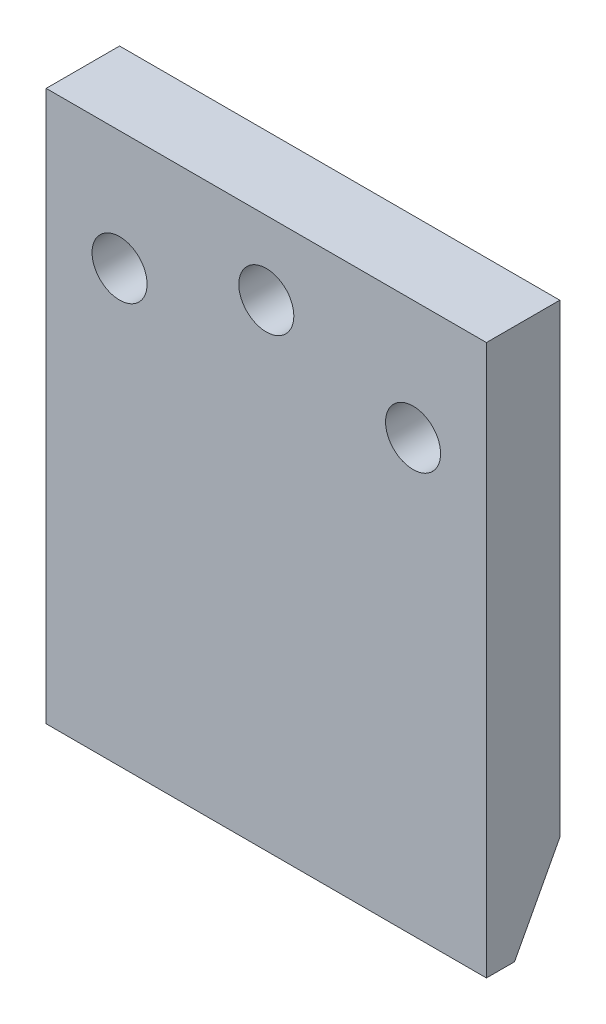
SolidWorks part; units mm, degrees
ref_plane "Front Plane" through (0, 0, 0) normal (0, 0, 1) x (1, 0, 0)
ref_plane "Top Plane" through (0, 0, 0) normal (0, 1, 0) x (1, 0, 0)
ref_plane "Right Plane" through (0, 0, 0) normal (1, 0, 0) x (0, 0, -1)
sketch "Sketch1" plane through (0, 0, 0) normal (0, 0, 1) x (1, 0, 0)
  line L0 (0, 0) -> (0, 3.937) construction
  line L1 (38.1, 47.625) -> (-38.1, 47.625)
  line L2 (38.1, 47.625) -> (38.1, -47.625)
  line L3 (38.1, -47.625) -> (-38.1, -47.625)
  line L4 (-38.1, 47.625) -> (-38.1, -47.625)
  line L5 (38.1, 47.625) -> (-38.1, -47.625) construction
  line L6 (38.1, -47.625) -> (-38.1, 47.625) construction
  circle A0 centre (0, 34.925) radius 4.7625
  circle A1 centre (-25.4, 27.0002) radius 4.7625
  circle A2 centre (25.4, 27.0002) radius 4.7625
  point P0 (0, 0)
  dimension "D4" = 9.525
  dimension "D1" = 95.25
  dimension "D2" = 76.2
  dimension "D5" = 12.7
  dimension "D6" = 7.9248
  dimension "D7" = 50.8
sketch "Sketch2" plane through (0, 0, 0) normal (0, 0, 1) x (1, 0, 0)
  line L0 (-38.1, 47.625) -> (-38.1, -47.625) construction
  line L1 (38.1, -47.625) -> (-38.1, -47.625) construction
  line L2 (38.1, 47.625) -> (38.1, -47.625) construction
  line L3 (38.1, 47.625) -> (-38.1, 47.625) construction
  line L4 (-38.1, 47.625) -> (-38.1, -47.625)
  line L5 (38.1, -47.625) -> (-38.1, -47.625)
  line L6 (38.1, 47.625) -> (38.1, -47.625)
  line L7 (38.1, 47.625) -> (-38.1, 47.625)
  circle A0 centre (-25.4, 27.0002) radius 4.7625 construction
  circle A1 centre (0, 34.925) radius 4.7625 construction
  circle A2 centre (25.4, 27.0002) radius 4.7625 construction
  circle A3 centre (-25.4, 27.0002) radius 4.7625
  circle A4 centre (0, 34.925) radius 4.7625
  circle A5 centre (25.4, 27.0002) radius 4.7625
extrude "Boss-Extrude1" add sketch "Sketch2" against normal blind 12.7
chamfer "Chamfer1" distance 14.732 angle 28 1 edges at (0, -47.625, -12.7)
